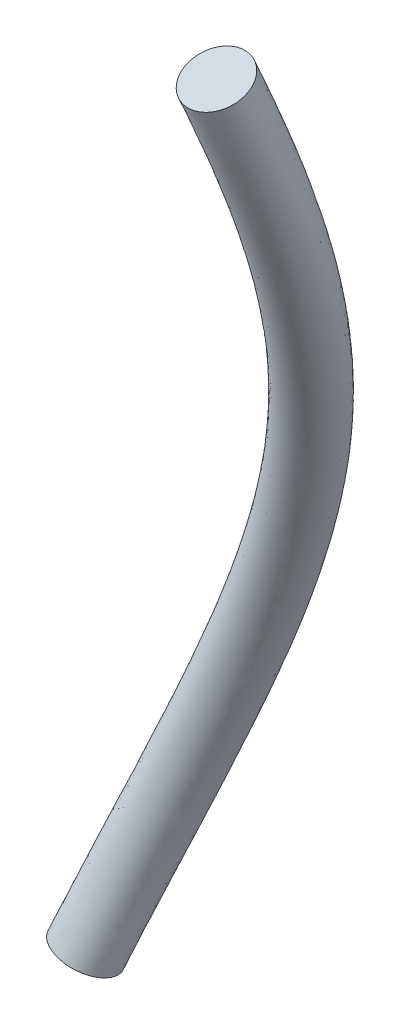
SolidWorks part; units mm, degrees
ref_plane "Front Plane" through (0, 0, 0) normal (0, 0, 1) x (1, 0, 0)
ref_plane "Top Plane" through (0, 0, 0) normal (0, 1, 0) x (1, 0, 0)
ref_plane "Right Plane" through (0, 0, 0) normal (1, 0, 0) x (0, 0, -1)
sketch "Sketch1" plane through (0, 0, 0) normal (0, 1, 0) x (1, 0, 0)
  circle A0 centre (-37.5973, 18.739) radius 3.175
  dimension "D1" = 6.35
curve "Helix/Spiral1"
ref_plane "Plane1" through (-34.4614, 19.05, -18.2423) normal (-0.0604, 0.9224, 0.3816) x (-0.2717, 0.3527, -0.8954)
sketch "Sketch2" plane through (-34.4614, 19.05, -18.2423) normal (-0.0604, 0.9224, 0.3816) x (-0.2717, 0.3527, -0.8954)
  circle A0 centre (-0.0211, 0.0026) radius 0.5953
  dimension "D1" = 1.1906
sweep "Sweep1" add profiles "Sketch2" path "Helix/Spiral1"
